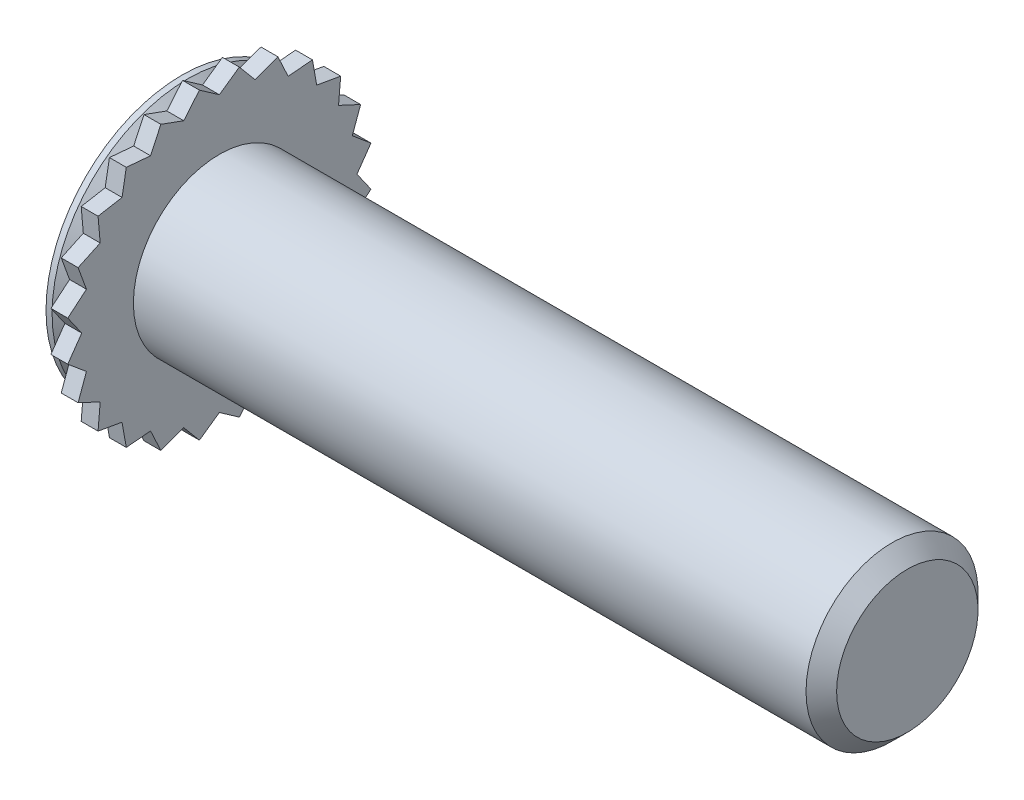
SolidWorks part; units mm, degrees
ref_plane "Plane1" through (0, 0, 0) normal (0, 0, 1) x (1, 0, 0)
ref_plane "Plane2" through (0, 0, 0) normal (0, 1, 0) x (1, 0, 0)
ref_plane "Plane3" through (0, 0, 0) normal (1, 0, 0) x (0, 0, -1)
sketch "BodySke" plane through (0, 0, 0) normal (0, 0, 1) x (1, 0, 0)
  line L0 (0, 2.2225) -> (0, 3.95)
  line L1 (1.09, 4.445) -> (0.5995, 4.445)
  line L2 (0.5995, 4.445) -> (0.5995, 3.6373)
  line L3 (1.09, 2.5) -> (20.645, 2.5)
  line L4 (21.09, 2.055) -> (21.09, 0)
  line L5 (21.09, 0) -> (0.545, 0)
  line L6 (0, 0) -> (50.554, 0) construction
  line L7 (1.09, 4.445) -> (1.09, 2.5)
  line L8 (21.09, 2.055) -> (20.645, 2.5)
  line L9 (0.5995, 3.6373) -> (0.4905, 3.6373)
  line L10 (0.4905, 3.6373) -> (0.1778, 3.95)
  line L11 (1.89, 19.05) -> (1.89, -3.175) construction
  line L12 (0.1778, 3.95) -> (0, 3.95)
  line L13 (0, 2.2225) -> (0.545, 1.6775)
  line L14 (0.545, 1.6775) -> (0.545, 0)
  dimension "D1" = 45
  dimension "Diameter" = 5
  dimension "Length" = 20
  dimension "Body_ch_ang" = 45
  dimension "Minor_dia" = 4.11
  dimension "Advance" = 0.8
  dimension "A_dim" = 1.09
  dimension "Clinch_ht" = 0.4905
  dimension "E_dia" = 8.89
  dimension "C_dia" = 7.9
  dimension "C_len" = 0.1778
  dimension "Skirt_ht" = 0.4905
  dimension "Face_clr_dep" = 0.545
  dimension "Face_clr_dia" = 4.445
  dimension "Face_clr_ang" = 45
revolve "BaseBody" add sketch "BodySke" angle 360 about L6
sketch "ThdSchSke" plane through (0, 0, 0) normal (0, 0, 1) x (1, 0, 0)
  line L0 (2.69, -2.055) -> (2.3784, -2.5)
  line L1 (2.69, -2.055) -> (3.0016, -2.5)
  line L2 (3.0016, -2.5) -> (3.0016, -3.125)
  line L3 (-3.175, 0) -> (5.1513, 0) construction
  line L5 (3.0016, -3.125) -> (2.3784, -3.125)
  line L6 (2.3784, -3.125) -> (2.3784, -2.5)
  line L8 (1.09, -2.5) -> (1.09, 2.5) construction
  dimension "Thread_minor" = 4.11
  dimension "Diameter" = 5
  dimension "Start" = 1.6
  dimension "SideAngle" = 55
  dimension "VeeAngle" = 70
  dimension "Overcut" = 6.25
revolve "ThreadSchematic" [suppressed] cut sketch "ThdSchSke" angle 360 about L3
pattern_linear "ThdSchPat" [suppressed]
sketch "CliRinCutSke" plane through (1.09, 0, 0) normal (1, 0, 0) x (0, 0, -1)
  line L0 (0, 0) -> (0, 4.8256) construction
  line L1 (0.5802, 4.407) -> (0, 4.0005)
  line L2 (0, 4.0005) -> (-0.5802, 4.407)
  arc A0 (0.5802, 4.407) -> (-0.5802, 4.407) centre (0, 0) ccw
  circle A1 centre (0, 0) radius 4.445 construction
  circle A2 centre (0, 0) radius 4.0005 construction
  dimension "Clinch_minor" = 8.001
  dimension "Angle" = 15
extrude "ClinchCut" cut sketch "CliRinCutSke" against normal blind 0.4905
pattern_circular "ClinchCutPat" count 24 every 15 about axis through (0, 0, 0) along (1, 0, 0) of "ClinchCut"
equation "' \"Length@BodySke\" = 20"
equation "' \"A_dim@BodySke\" = 1.09"
equation "' \"E_dia@BodySke\" = 8.89"
equation "' \"C_dia@BodySke\" = 7.9"
equation "' \"Diameter@BodySke\" = 5"
equation "' \"Minor_dia@BodySke\" = 4.11"
equation "' \"Advance@BodySke\" = 0.8"
equation "\"Face_clr_dia@BodySke\" = \"E_dia@BodySke\" / 2"
equation "\"Face_clr_dep@BodySke\" = \"A_dim@BodySke\" / 2"
equation "\"Start@ThdSchSke\" = 1.6"
equation "\"Skirt_ht@BodySke\" = \"A_dim@BodySke\" * 0.45"
equation "\"Clinch_ht@BodySke\" = \"A_dim@BodySke\" * 0.45"
equation "\"Depth@ClinchCut\" = \"A_dim@BodySke\" * 0.45"
equation "\"Count@ClinchCutPat\" = 24"
equation "\"Angle@ClinchCutPat\" = 360 / \"Count@ClinchCutPat\""
equation "\"Angle@CliRinCutSke\" = 360 / \"Count@ClinchCutPat\""
equation "\"Clinch_minor@CliRinCutSke\" =  \"C_dia@BodySke\" "
equation "\"Clinch_minor@CliRinCutSke\" =  \"E_dia@BodySke\" * 0.9"
equation "\"Thread_length@ThreadCosmetic\" = \"Length@BodySke\" - \"Start@ThdSchSke\""
equation "\"Thread_minor@ThreadCosmetic\" = \"Minor_dia@BodySke\""
equation "\"Thread_minor@ThdSchSke\" = \"Minor_dia@BodySke\""
equation "\"Diameter@ThdSchSke\" = \"Diameter@BodySke\""
equation "\"Overcut@ThdSchSke\" = \"Diameter@BodySke\" * 1.25"
equation "\"Num_threads@ThdSchPat\" = int( \"Thread_length@ThreadCosmetic\" / \"Advance@BodySke\" + 0.999 )  + 1"
equation "\"Advance@ThdSchPat\" = \"Thread_length@ThreadCosmetic\" /  (\"Num_threads@ThdSchPat\" - 1) 'relax it"
equation "\"Num_threads@ThdSchPat\" = \"Num_threads@ThdSchPat\" - sgn( \"Num_threads@ThdSchPat\" - 1) '---chamfered tips only---"
